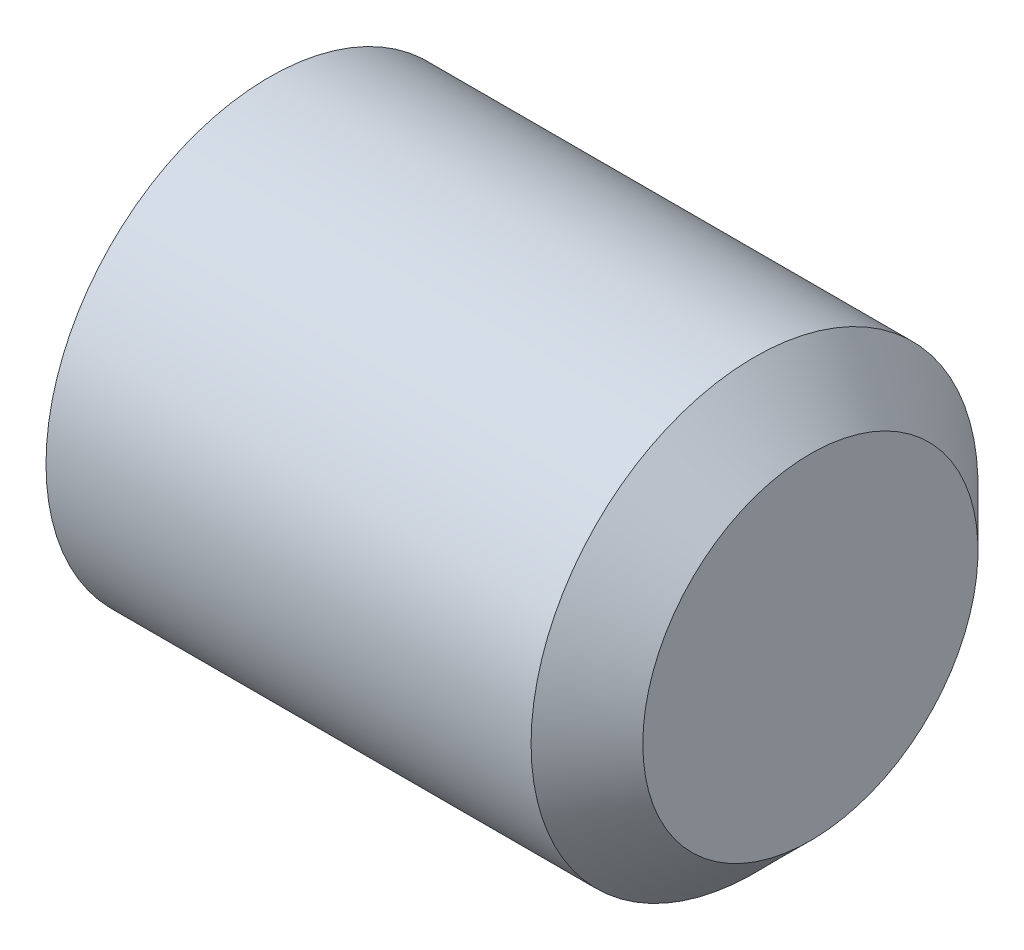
SolidWorks part; units mm, degrees
ref_plane "Plane1" through (0, 0, 0) normal (0, 0, 1) x (1, 0, 0)
ref_plane "Plane2" through (0, 0, 0) normal (0, 1, 0) x (1, 0, 0)
ref_plane "Plane3" through (0, 0, 0) normal (1, 0, 0) x (0, 0, -1)
sketch "BodySke" plane through (0, 0, 0) normal (0, 0, 1) x (1, 0, 0)
  line L0 (0, 0) -> (0, 10.352)
  line L1 (0, 10.352) -> (0.9515, 12)
  line L2 (0.9515, 12) -> (27, 12)
  line L3 (27, 12) -> (30, 9)
  line L4 (30, 0) -> (0, 0)
  line L5 (-12.7, 0) -> (88.9, 0) construction
  line L6 (30, 9) -> (30, 0)
  line L7 (30, 9) -> (30, 18.525) construction
  line L8 (0, -10.352) -> (0.9515, -12) construction
  line L9 (3, 15.875) -> (3, -3.175) construction
  line L10 (27, -12) -> (30, -9) construction
  dimension "Length" = 30
  dimension "Diameter" = 24
  dimension "Drive_ch_ang" = 60
  dimension "Minor_dia" = 20.704
  dimension "Cup_nose_ang" = 45
  dimension "Cup_dia" = 18
  dimension "Advance" = 3
revolve "BaseBody" add sketch "BodySke" angle 360 about L5
sketch "Sketch2" plane through (0, 0, 0) normal (-1, 0, 0) x (0, 0, 1)
  line L0 (3.4641, 6) -> (-3.4641, 6)
  line L1 (-3.4641, 6) -> (-6.9282, 0)
  line L2 (3.4641, 6) -> (6.9282, 0)
  line L3 (3.4641, -6) -> (6.9282, 0)
  line L4 (3.4641, -6) -> (-3.4641, -6)
  line L5 (-3.4641, -6) -> (-6.9282, 0)
  dimension "Hex_size" = 12
  dimension "D2" = 6
  dimension "D3" = 6
extrude "Hex" [suppressed] cut sketch "Sketch2" against normal blind 12
sketch "Sketch4" plane through (0, 4.7709, -0.5249) normal (-1, 0, 0) x (0, 0, 1)
  line L0 (0.5249, -4.7709) -> (8.1959, -4.7709)
  line L1 (0.5249, -4.7709) -> (6.6732, -1.2211) construction
  line L2 (0.5249, -4.7709) -> (4.3604, 1.8724)
  line L3 (6.7899, -3.1774) -> (7.8687, -2.5545)
  line L4 (5.0374, -0.142) -> (6.1162, 0.4809)
  arc A0 (6.7899, -3.1774) -> (5.0374, -0.142) centre (0.5249, -4.7709) ccw
  arc A1 (8.1959, -4.7709) -> (7.8687, -2.5545) centre (0.5249, -4.7709) ccw
  arc A2 (4.3604, 1.8724) -> (6.1162, 0.4809) centre (0.5249, -4.7709) cw
  circle A3 centre (0.5249, -4.7709) radius 6.4645 construction
  circle A4 centre (0.5249, -4.7709) radius 7.671 construction
  dimension "D1" = 30
  dimension "Spline_n_dim" = 12.929
  dimension "Spline_m_dim" = 15.342
  dimension "Spline_a_dim" = 60
  dimension "D3" = 1.7525
  dimension "Spline_p_dim" = 3.505
extrude "Spline6" [suppressed] cut sketch "Sketch4" against normal blind 12
pattern_circular "CirPattern1" [suppressed] count 6 every 60 about axis through (-12.7, 0, 0) along (1, 0, 0)
sketch "Sketch5" plane through (0, 0.6556, 6.6316) normal (-1, 0, 0) x (0, 0, 1)
  line L0 (-6.6316, -0.6556) -> (1.0394, -0.6556)
  line L1 (-6.6316, -0.6556) -> (-1.6115, 4.3645) construction
  line L2 (-6.6316, -0.6556) -> (-6.6316, 7.0154)
  line L3 (-0.8213, 2.6763) -> (-0.1116, 3.386)
  line L4 (-3.2997, 5.1547) -> (-2.5901, 5.8644)
  line L5 (-3.2997, 5.1547) -> (-0.8213, 2.6763)
  arc A1 (1.0394, -0.6556) -> (-0.1116, 3.386) centre (-6.6316, -0.6556) ccw
  arc A2 (-6.6316, 7.0154) -> (-2.5901, 5.8644) centre (-6.6316, -0.6556) cw
  circle A3 centre (-6.6316, -0.6556) radius 6.4645 construction
  circle A4 centre (-6.6316, -0.6556) radius 7.671 construction
  dimension "D1" = 45
  dimension "Spline_n_dim" = 12.929
  dimension "Spline_m_dim" = 15.342
  dimension "Spline_a_dim" = 90
  dimension "D3" = 1.7525
  dimension "Spline_p_dim" = 3.505
extrude "Spline4" [suppressed] cut sketch "Sketch5" against normal blind 12
pattern_circular "CirPattern2" [suppressed] count 4 every 90 about axis through (-12.7, 0, 0) along (1, 0, 0)
sketch "ThdSchSke" plane through (0, 0, 0) normal (0, 0, 1) x (1, 0, 0)
  line L0 (0.9515, -10.352) -> (-0.2025, -12)
  line L1 (0.9515, -10.352) -> (2.1054, -12)
  line L2 (2.1054, -12) -> (2.1054, -15)
  line L3 (-3.175, 0) -> (5.1513, 0) construction
  line L4 (0.9515, 12) -> (0.9515, -12) construction
  line L5 (2.1054, -15) -> (-0.2025, -15)
  line L6 (-0.2025, -15) -> (-0.2025, -12)
  dimension "Thread_minor" = 20.704
  dimension "Diameter" = 24
  dimension "SideAngle" = 55
  dimension "VeeAngle" = 70
  dimension "Overcut" = 30
revolve "ThreadSchematic" [suppressed] cut sketch "ThdSchSke" angle 360 about L3
pattern_linear "ThdSchPat" [suppressed]
equation "\"D2@Sketch2\" = \"Hex_size@Sketch2\" / 2"
equation "\"D3@Sketch2\" = \"Hex_size@Sketch2\" / 2"
equation "\"Thread_minor@ThreadCosmetic\" = \"Minor_dia@BodySke\""
equation "\"D1@Sketch4\" = \"Spline_a_dim@Sketch4\" / 2"
equation "\"D3@Sketch4\" = \"Spline_p_dim@Sketch4\" / 2"
equation "\"D2@CirPattern1\" = \"Spline_a_dim@Sketch4\""
equation "\"Num_teeth@CirPattern1\" = 360 / \"D2@CirPattern1\""
equation "\"Spline_a_dim@Sketch5\" = 90"
equation "\"Spline_p_dim@Sketch5\" = \"Spline_p_dim@Sketch4\""
equation "\"Spline_m_dim@Sketch5\" = \"Spline_m_dim@Sketch4\""
equation "\"Spline_n_dim@Sketch5\" = \"Spline_n_dim@Sketch4\""
equation "\"D1@Sketch5\" = \"Spline_a_dim@Sketch5\" / 2"
equation "\"D3@Sketch5\" = \"Spline_p_dim@Sketch5\" / 2"
equation "\"Key_eng@Spline4\" = \"Key_eng@Spline6\""
equation "\"Thread_minor@ThdSchSke\" = \"Thread_minor@ThreadCosmetic\""
equation "\"Diameter@ThdSchSke\" = \"Diameter@BodySke\""
equation "\"Overcut@ThdSchSke\" = \"Diameter@BodySke\" * 1.25"
equation "\"Num_threads@ThdSchPat\" = int( (\"Length@BodySke\" - ( ( ( \"Diameter@BodySke\" - \"Minor_dia@BodySke\" ) * 0.5 ) / tan( \"Drive_ch_ang@BodySke\" * 0.017453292 ) ) - ( ( ( \"Diameter@BodySke\" - \"Cup_dia@BodySk"
equation "\"Advance@ThdSchPat\" = (\"Length@BodySke\" - ( ( ( \"Diameter@BodySke\" - \"Minor_dia@BodySke\" ) * 0.5 ) / tan( \"Drive_ch_ang@BodySke\" * 0.017453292 ) ) - ( ( ( \"Diameter@BodySke\" - \"Cup_dia@BodySke\" ) * 0."
equation "' \"Num_threads@ThdSchPat\" = \"Num_threads@ThdSchPat\" - sgn( \"Num_threads@ThdSchPat\" - 1) '---chamfered tips only---"
